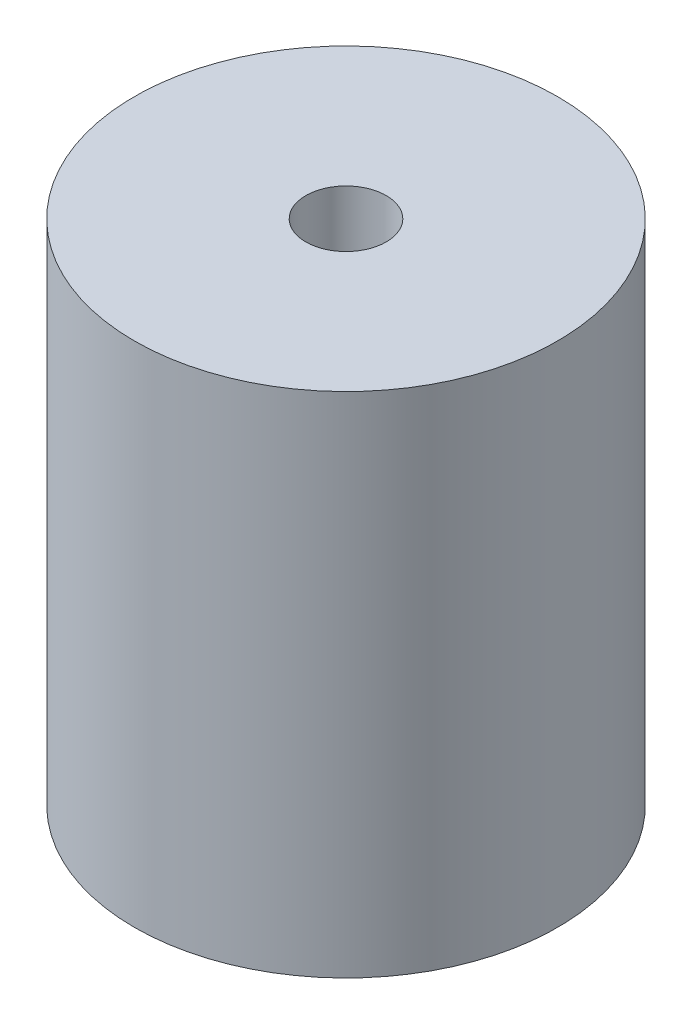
SolidWorks part; units mm, degrees
ref_plane "Front Plane" through (0, 0, 0) normal (0, 0, 1) x (1, 0, 0)
ref_plane "Top Plane" through (0, 0, 0) normal (0, 1, 0) x (1, 0, 0)
ref_plane "Right Plane" through (0, 0, 0) normal (1, 0, 0) x (0, 0, -1)
sketch "Sketch1" plane through (0, 0, 0) normal (0, 1, 0) x (1, 0, 0)
  circle A0 centre (0, 0) radius 5
  circle A1 centre (0, 0) radius 0.95
  dimension "D1" = 1.9
  dimension "D2" = 10
extrude "Extrude1" add sketch "Sketch1" along normal blind 12
